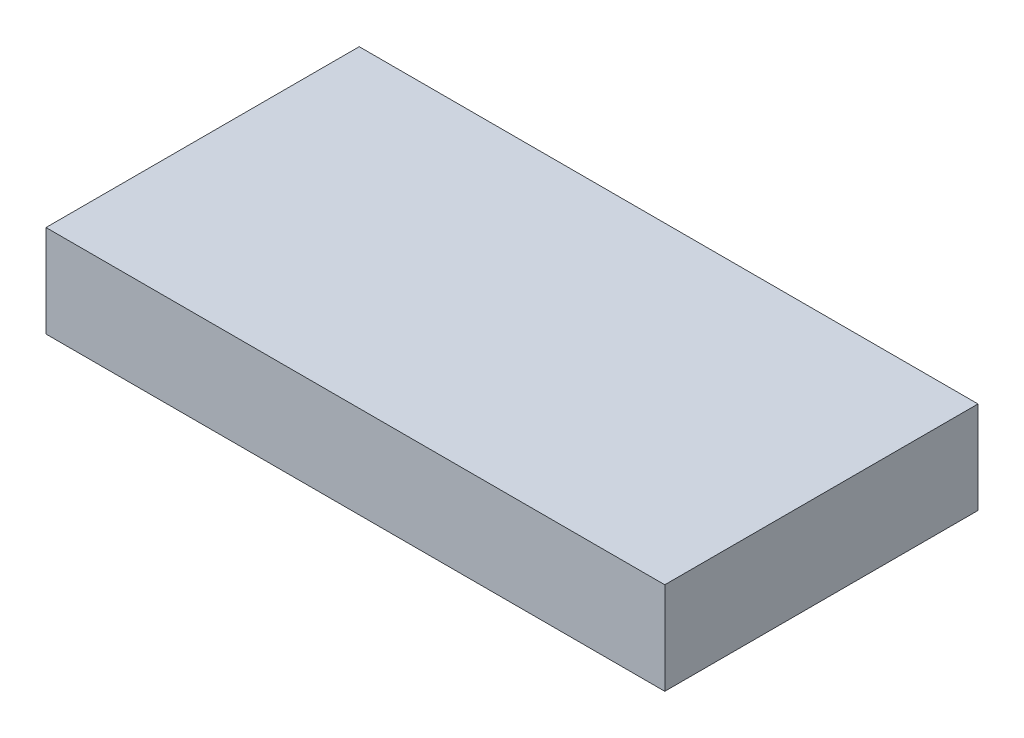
SolidWorks part; units mm, degrees
ref_plane "Front Plane" through (0, 0, 0) normal (0, 0, 1) x (1, 0, 0)
ref_plane "Top Plane" through (0, 0, 0) normal (0, 1, 0) x (1, 0, 0)
ref_plane "Right Plane" through (0, 0, 0) normal (1, 0, 0) x (0, 0, -1)
sketch "Sketch1" plane through (0, 0, 0) normal (0, 1, 0) x (1, 0, 0)
  line L0 (0, 0) -> (0, 59.182) construction
  line L1 (0, 59.182) -> (5, 59.182)
  line L2 (5, 59.182) -> (5, 44.182)
  line L3 (5, 44.182) -> (10, 44.182)
  line L4 (0, 0) -> (0, 59.182)
  line L5 (10, 15) -> (5, 15)
  line L6 (5, 15) -> (5, 0)
  line L7 (5, 0) -> (0, 0)
  arc A0 (10, 44.182) -> (10.6036, 36.2048) centre (7.3104, 39.967) cw
  arc A1 (10, 15) -> (10.6036, 17.8404) centre (5.6218, 17.4147) ccw
  arc A2 (10.6036, 36.2048) -> (10.6036, 17.8404) centre (44.5633, 27.0226) ccw
  dimension "D6" = 5
  dimension "D1" = 59.182
  dimension "D2" = 5
  dimension "D3" = 5
  dimension "D4" = 15
  dimension "D5" = 15
  dimension "D7" = 8
  dimension "D8" = 5
revolve "Revolve1" add sketch "Sketch1" angle 180 about L0
sketch "Sketch2" plane through (0, 0, 0) normal (0, 1, 0) x (1, 0, 0)
  line L0 (0, 59.182) -> (0, 0) construction
  line L1 (-5, 59.182) -> (5, 59.182) construction
  line L3 (-34.5, 64.516) -> (34.5, 64.516)
  line L4 (-34.5, 64.516) -> (-34.5, -5.334)
  line L5 (-34.5, -5.334) -> (34.5, -5.334)
  line L6 (34.5, 64.516) -> (34.5, -5.334)
  line L7 (-34.5, 64.516) -> (34.5, -5.334) construction
  line L8 (-34.5, -5.334) -> (34.5, 64.516) construction
  point P5 (0, 29.591)
  dimension "D1" = 69
  dimension "D2" = 69.85
extrude "Boss-Extrude1" add sketch "Sketch2" along normal blind 3
sketch "Sketch3" plane through (0, 0, 0) normal (0, -1, 0) x (1, 0, 0)
  line L0 (-31.5, 2.334) -> (-31.5, -61.516)
  line L1 (-34.5, 5.334) -> (34.5, 5.334)
  line L2 (-34.5, 5.334) -> (-34.5, -64.516)
  line L3 (-34.5, -64.516) -> (34.5, -64.516)
  line L4 (34.5, 5.334) -> (34.5, -64.516)
  line L5 (-31.5, -61.516) -> (31.5, -61.516)
  line L6 (31.5, 2.334) -> (31.5, -61.516)
  line L7 (-31.5, 2.334) -> (31.5, 2.334)
  dimension "D1" = 3
extrude "Boss-Extrude2" add sketch "Sketch3" along normal blind 17.58
sketch "Sketch7" plane through (0, 0, 0) normal (0, 0, 1) x (1, 0, 0)
  circle A0 centre (0, 0) radius 2.762
extrude "Boss-Extrude5" add sketch "Sketch7" along normal blind 4.84
mirror "Mirror3" about plane through (34.5, 3, -64.516) normal (-1, 0, 0)
sketch "Sketch13" plane through (0, 0, 0) normal (0, -1, 0) x (1, 0, 0)
  line L0 (-23.5, -2.666) -> (-23.5, -7.666) construction
  line L1 (31.5, 2.334) -> (-31.5, 2.334) construction
  line L2 (-31.5, 2.334) -> (-31.5, -61.516) construction
  line L3 (-23.5, -2.666) -> (-23.5, -7.666)
  arc A0 (-23.5, -7.666) -> (-23.5, -2.666) centre (-23.5, -5.166) ccw
  dimension "D1" = 5
  dimension "D2" = 5
  dimension "D3" = 8
revolve "Revolve3" add sketch "Sketch13" angle 180 about L0
sketch "Sketch14" plane through (0, 0, 0) normal (0, -1, 0) x (1, 0, 0)
  line L0 (23.5, -2.666) -> (23.5, -7.666) construction
  line L1 (31.5, 2.334) -> (-31.5, 2.334) construction
  line L2 (31.5, -61.516) -> (31.5, 2.334) construction
  line L3 (23.5, -2.666) -> (23.5, -7.666)
  arc A0 (23.5, -2.666) -> (23.5, -7.666) centre (23.5, -5.166) ccw
  dimension "D1" = 5
  dimension "D2" = 5
  dimension "D3" = 8
revolve "Revolve6" add sketch "Sketch14" angle 360 about L3
sketch "Sketch15" plane through (0, 0, 0) normal (0, -1, 0) x (1, 0, 0)
  line L0 (-23.5, -51.516) -> (-23.5, -56.516) construction
  line L1 (-31.5, -61.516) -> (31.5, -61.516) construction
  line L2 (-31.5, 2.334) -> (-31.5, -61.516) construction
  line L3 (-23.5, -51.516) -> (-23.5, -56.516)
  arc A0 (-23.5, -56.516) -> (-23.5, -51.516) centre (-23.5, -54.016) ccw
  dimension "D1" = 5
  dimension "D2" = 5
  dimension "D3" = 8
revolve "Revolve7" add sketch "Sketch15" angle 360 about L0
sketch "Sketch16" plane through (0, 0, 0) normal (0, -1, 0) x (1, 0, 0)
  line L0 (23.5, -51.516) -> (23.5, -56.516) construction
  line L1 (-31.5, -61.516) -> (31.5, -61.516) construction
  line L2 (31.5, -61.516) -> (31.5, 2.334) construction
  line L3 (23.5, -51.516) -> (23.5, -56.516)
  arc A0 (23.5, -51.516) -> (23.5, -56.516) centre (23.5, -54.016) ccw
  dimension "D1" = 5
  dimension "D2" = 5
  dimension "D3" = 8
revolve "Revolve8" add sketch "Sketch16" angle 360 about L0
sketch "Sketch17" plane through (0, 0, 0) normal (0, -1, 0) x (1, 0, 0)
  line L0 (45.5, -7.666) -> (45.5, -2.666) construction
  line L1 (37.5, 2.334) -> (66.238, 2.334) construction
  line L2 (37.5, -61.516) -> (37.5, 2.334) construction
  line L3 (45.5, -7.666) -> (45.5, -2.666)
  arc A0 (45.5, -7.666) -> (45.5, -2.666) centre (45.5, -5.166) ccw
  dimension "D1" = 5
  dimension "D2" = 5
  dimension "D3" = 8
revolve "Cut-Revolve2" cut sketch "Sketch17" angle 360 about L0
sketch "Sketch18" plane through (0, 0, 0) normal (0, -1, 0) x (1, 0, 0)
  line L0 (92.5, -7.666) -> (92.5, -2.666) construction
  line L1 (37.5, 2.334) -> (100.5, 2.334) construction
  line L2 (100.5, 2.334) -> (100.5, -61.516) construction
  line L3 (92.5, -7.666) -> (92.5, -2.666)
  arc A0 (92.5, -2.666) -> (92.5, -7.666) centre (92.5, -5.166) ccw
  dimension "D1" = 5
  dimension "D2" = 5
  dimension "D3" = 8
revolve "Cut-Revolve3" cut sketch "Sketch18" angle 360 about L0
sketch "Sketch19" plane through (0, 0, 0) normal (0, -1, 0) x (1, 0, 0)
  line L0 (45.5, -56.516) -> (45.5, -51.516) construction
  line L1 (37.5, -61.516) -> (37.5, 2.334) construction
  line L2 (100.5, -61.516) -> (37.5, -61.516) construction
  line L3 (45.5, -56.516) -> (45.5, -51.516)
  arc A0 (45.5, -56.516) -> (45.5, -51.516) centre (45.5, -54.016) ccw
  dimension "D1" = 5
  dimension "D2" = 8
  dimension "D3" = 5
revolve "Cut-Revolve4" cut sketch "Sketch19" angle 360 about L0
sketch "Sketch20" plane through (0, 0, 0) normal (0, -1, 0) x (1, 0, 0)
  line L0 (92.5, -51.516) -> (92.5, -56.516) construction
  line L1 (100.5, -61.516) -> (37.5, -61.516) construction
  line L2 (100.5, 2.334) -> (100.5, -61.516) construction
  line L3 (92.5, -51.516) -> (92.5, -56.516)
  arc A0 (92.5, -51.516) -> (92.5, -56.516) centre (92.5, -54.016) ccw
  dimension "D1" = 5
  dimension "D2" = 5
  dimension "D3" = 8
revolve "Cut-Revolve5" cut sketch "Sketch20" angle 360 about L0
